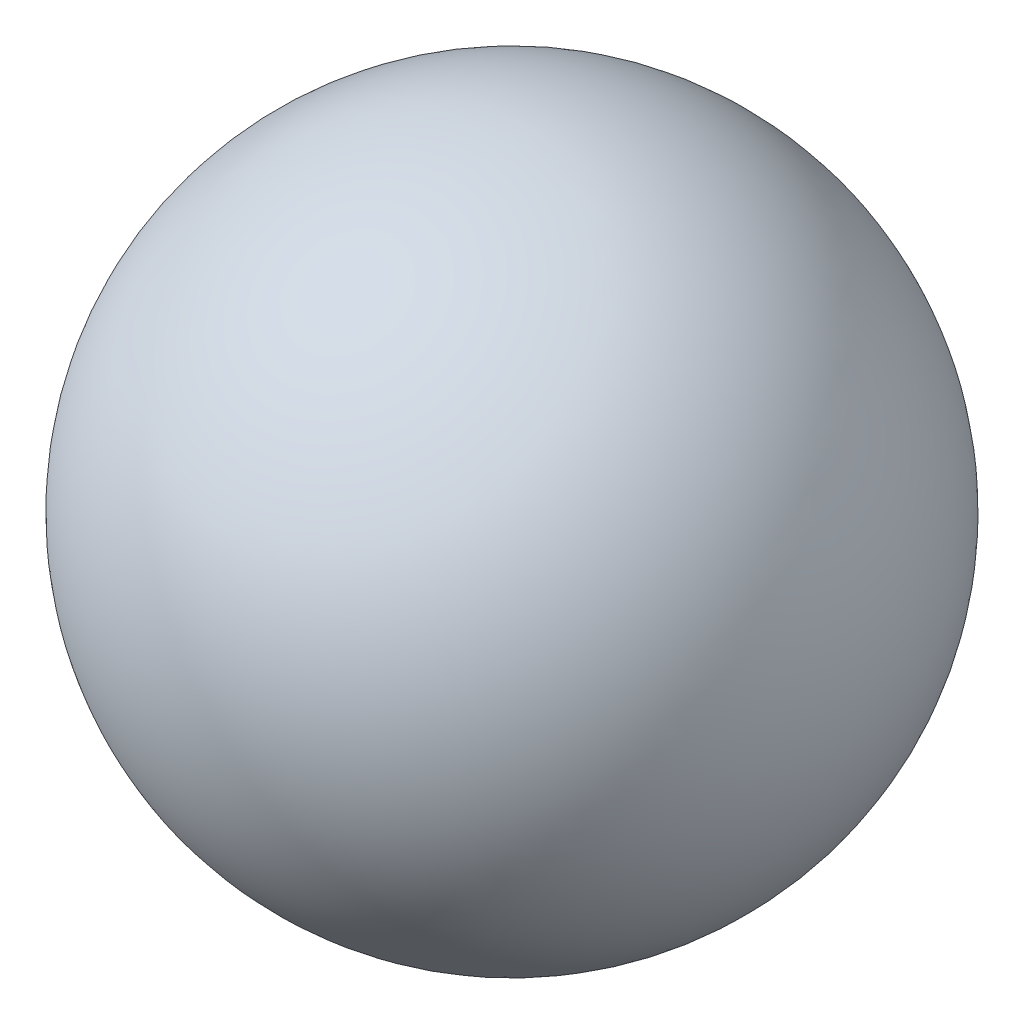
SolidWorks part; units mm, degrees
ref_plane "Front Plane" through (0, 0, 0) normal (0, 0, 1) x (1, 0, 0)
ref_plane "Top Plane" through (0, 0, 0) normal (0, 1, 0) x (1, 0, 0)
ref_plane "Right Plane" through (0, 0, 0) normal (1, 0, 0) x (0, 0, -1)
sketch "Sketch1" plane through (0, 0, 0) normal (1, 0, 0) x (0, 0, -1)
  line L0 (-2.5, 0) -> (2.5, 0)
  arc A0 (2.5, 0) -> (-2.5, 0) centre (0, 0) ccw
  dimension "D1" = 2.5
revolve "Revolve1" add sketch "Sketch1" angle 360 about L0
